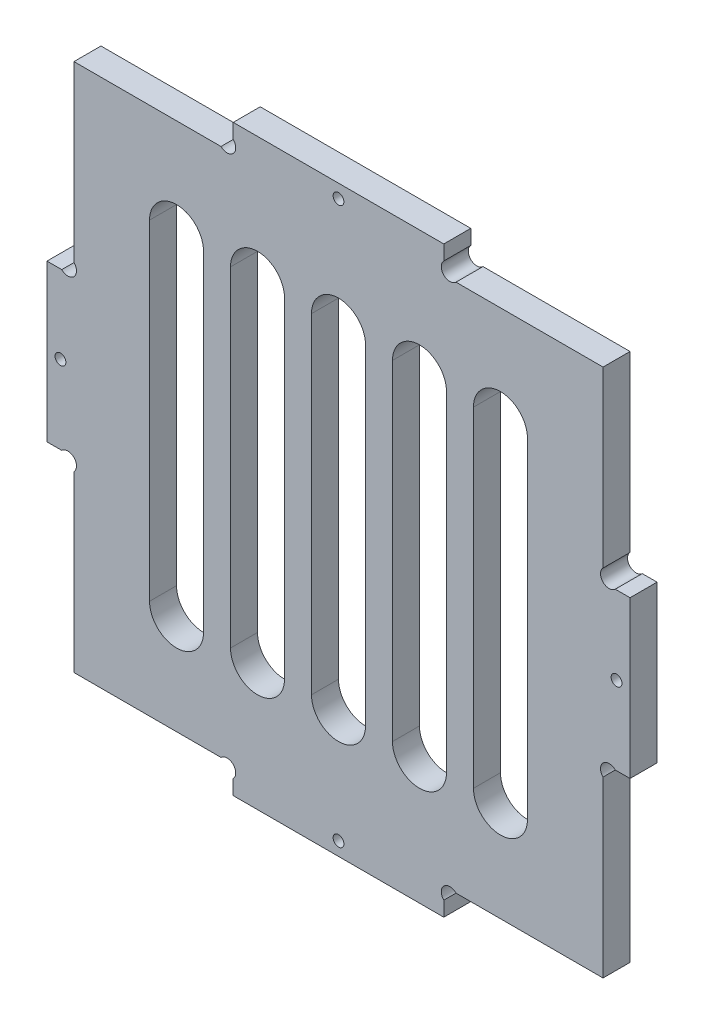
SolidWorks part; units mm, degrees
ref_plane "Plan de face" through (0, 0, 0) normal (0, 0, 1) x (1, 0, 0)
ref_plane "Plan de dessus" through (0, 0, 0) normal (0, 1, 0) x (1, 0, 0)
ref_plane "Plan de droite" through (0, 0, 0) normal (1, 0, 0) x (0, 0, -1)
sketch "Esquisse1" plane through (0, 0, 0) normal (0, 0, 1) x (1, 0, 0)
  line L0 (73.7466, -16.8241) -> (73.7466, -33.1604) construction
  line L1 (17.991, -73.0548) -> (37.4115, -73.0548) construction
  line L2 (71.2466, -36.0548) -> (87.8512, -52.6594) construction
  line L3 (41.7466, -70.5548) -> (53.279, -82.0873) construction
  line L4 (73.5093, -36.0548) -> (76.2466, -36.0548)
  line L5 (71.2466, -38.3175) -> (71.2466, -70.5548)
  line L6 (71.2466, -70.5548) -> (44.0093, -70.5548)
  line L7 (41.7466, -72.8175) -> (41.7466, -75.5548)
  line L8 (2.7466, -72.8175) -> (2.7466, -75.5548)
  line L9 (-26.7534, -70.5548) -> (0.4838, -70.5548)
  line L10 (-26.7534, -38.3175) -> (-26.7534, -70.5548)
  line L11 (-29.0162, -36.0548) -> (-31.7534, -36.0548)
  line L12 (-29.0162, -7.0548) -> (-31.7534, -7.0548)
  line L13 (-26.7534, -4.792) -> (-26.7534, 27.4452)
  line L14 (-26.7534, 27.4452) -> (0.4838, 27.4452)
  line L15 (2.7466, 29.708) -> (2.7466, 32.4452)
  line L16 (41.7466, 29.708) -> (41.7466, 32.4452)
  line L17 (71.2466, 27.4452) -> (44.0093, 27.4452)
  line L18 (71.2466, -4.792) -> (71.2466, 27.4452)
  line L19 (73.5093, -7.0548) -> (76.2466, -7.0548)
  line L20 (2.7466, -75.5548) -> (41.7466, -75.5548)
  line L21 (-31.7534, -36.0548) -> (-31.7534, -7.0548)
  line L22 (2.7466, 32.4452) -> (41.7466, 32.4452)
  line L23 (76.2466, -7.0548) -> (76.2466, -36.0548)
  line L24 (27.9526, -52.1248) -> (-8.0515, -52.1248) construction
  line L25 (17.2466, 9.0152) -> (17.2466, -52.1248)
  line L26 (27.2466, 9.0152) -> (27.2466, -52.1248)
  line L27 (32.2466, 9.0152) -> (32.2466, -52.1248)
  line L28 (42.2466, 9.0152) -> (42.2466, -52.1248)
  line L29 (47.2466, 9.0152) -> (47.2466, -52.1248)
  line L30 (57.2466, 9.0152) -> (57.2466, -52.1248)
  line L31 (12.2466, 9.0152) -> (12.2466, -52.1248)
  line L32 (22.2466, 70.6248) -> (22.2466, -113.7343) construction
  line L33 (133.1383, -21.5548) -> (-88.6451, -21.5548) construction
  line L34 (76.2466, -113.7343) -> (76.2466, -14.3987) construction
  line L35 (71.2466, -94.6292) -> (71.2466, -14.3987) construction
  line L36 (2.2466, 9.0152) -> (2.2466, -52.1248)
  line L37 (-2.7534, 9.0152) -> (-2.7534, -52.1248)
  line L38 (-12.7534, 9.0152) -> (-12.7534, -52.1248)
  line L42 (41.7466, -101.8282) -> (41.7466, -62.1057) construction
  line L43 (120.4774, -36.0548) -> (59.1925, -36.0548) construction
  line L44 (101.0445, -70.5548) -> (17.991, -70.5548) construction
  line L45 (137.0415, -75.5548) -> (17.991, -75.5548) construction
  arc A0 (73.5093, -36.0548) -> (71.2466, -38.3175) centre (72.3779, -37.1861) ccw
  arc A1 (44.0093, -70.5548) -> (41.7466, -72.8175) centre (42.8779, -71.6861) ccw
  circle A2 centre (73.7466, -21.5548) radius 1
  circle A3 centre (22.2466, -73.0548) radius 1
  circle A4 centre (-29.2534, -21.5548) radius 1
  arc A5 (0.4838, -70.5548) -> (2.7466, -72.8175) centre (1.6152, -71.6861) cw
  arc A6 (-29.0162, -36.0548) -> (-26.7534, -38.3175) centre (-27.8848, -37.1861) cw
  circle A7 centre (22.2466, 29.9452) radius 1
  arc A8 (-29.0162, -7.0548) -> (-26.7534, -4.792) centre (-27.8848, -5.9234) ccw
  arc A9 (0.4838, 27.4452) -> (2.7466, 29.708) centre (1.6152, 28.5766) ccw
  arc A10 (44.0093, 27.4452) -> (41.7466, 29.708) centre (42.8779, 28.5766) cw
  arc A11 (73.5093, -7.0548) -> (71.2466, -4.792) centre (72.3779, -5.9234) cw
  arc A12 (17.2466, -52.1248) -> (27.2466, -52.1248) centre (22.2466, -52.1248) ccw
  arc A13 (17.2466, 9.0152) -> (27.2466, 9.0152) centre (22.2466, 9.0152) cw
  arc A14 (32.2466, -52.1248) -> (42.2466, -52.1248) centre (37.2466, -52.1248) ccw
  arc A15 (32.2466, 9.0152) -> (42.2466, 9.0152) centre (37.2466, 9.0152) cw
  arc A16 (47.2466, -52.1248) -> (57.2466, -52.1248) centre (52.2466, -52.1248) ccw
  arc A17 (47.2466, 9.0152) -> (57.2466, 9.0152) centre (52.2466, 9.0152) cw
  arc A18 (2.2466, -52.1248) -> (12.2466, -52.1248) centre (7.2466, -52.1248) ccw
  arc A19 (2.2466, 9.0152) -> (12.2466, 9.0152) centre (7.2466, 9.0152) cw
  arc A20 (-12.7534, -52.1248) -> (-2.7534, -52.1248) centre (-7.7534, -52.1248) ccw
  arc A21 (-12.7534, 9.0152) -> (-2.7534, 9.0152) centre (-7.7534, 9.0152) cw
  dimension "D1" = 54
  dimension "D11" = 18.43
  dimension "D12" = 3
  dimension "D2" = 5
  dimension "D3" = 39.5
  dimension "D4" = 5
  dimension "D5" = 54
  dimension "D6" = 34.5
  dimension "D7" = 2.5
  dimension "D8" = 2.5
  dimension "D9" = 45
  dimension "D10" = 45
  dimension "D13" = 3
extrude "Boss.-Extru.1" add sketch "Esquisse1" along normal blind 5
